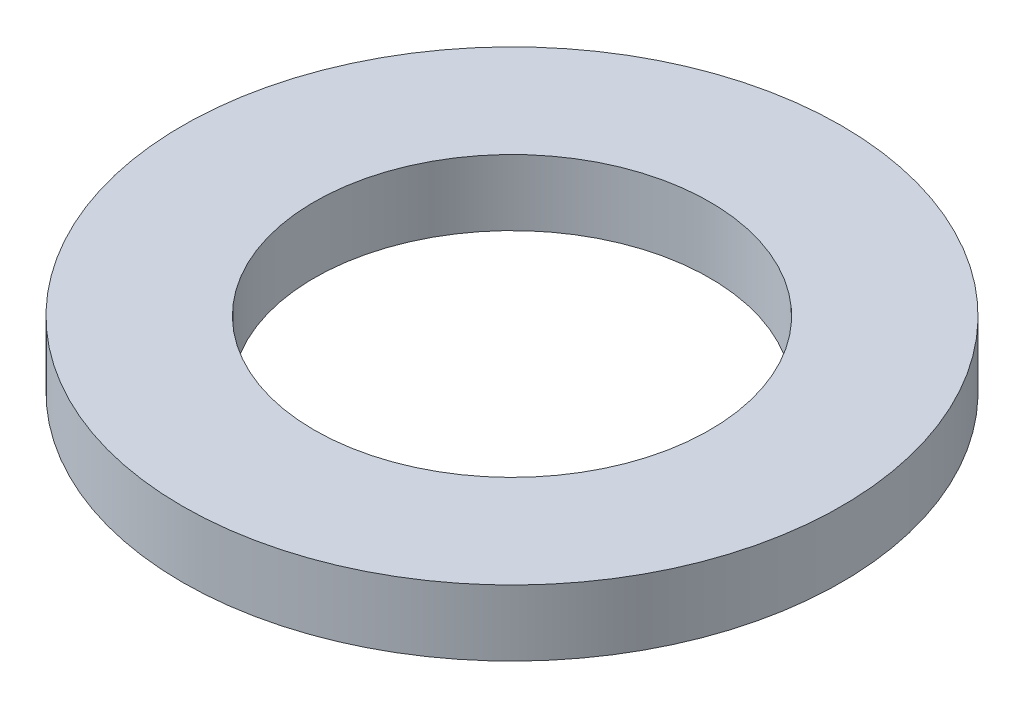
SolidWorks part; units mm, degrees
ref_plane "Plan de face" through (0, 0, 0) normal (0, 0, 1) x (1, 0, 0)
ref_plane "Plan de dessus" through (0, 0, 0) normal (0, 1, 0) x (1, 0, 0)
ref_plane "Plan de droite" through (0, 0, 0) normal (1, 0, 0) x (0, 0, -1)
sketch "Esquisse1" plane through (0, 0, 0) normal (0, 1, 0) x (1, 0, 0)
  circle A0 centre (0, 0) radius 40
  circle A1 centre (0, 0) radius 24
  dimension "D1" = 48
  dimension "D2" = 80
extrude "Extrusion1" add sketch "Esquisse1" along normal blind 8
